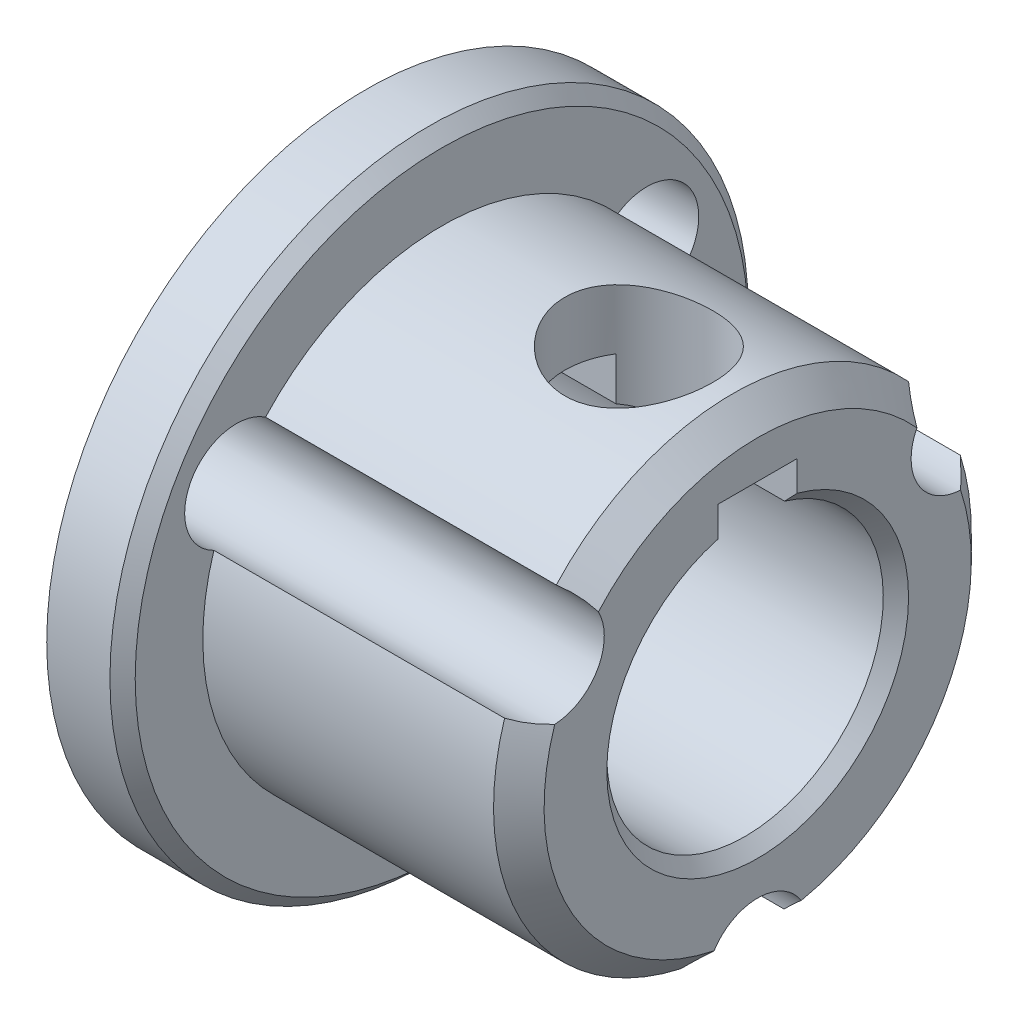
SolidWorks part; units mm, degrees
ref_plane "FRONT" through (0, 0, 0) normal (0, 0, 1) x (1, 0, 0)
ref_plane "TOP" through (0, 0, 0) normal (0, 1, 0) x (1, 0, 0)
ref_plane "SIDE" through (0, 0, 0) normal (1, 0, 0) x (0, 0, -1)
sketch "Sketch1" plane through (0, 0, 0) normal (0, 0, 1) x (1, 0, 0)
  line L0 (0, 0) -> (24.13, 0) construction
  line L1 (-3.048, 5.5562) -> (12.7, 5.5562)
  line L2 (12.7, 5.5562) -> (12.7, 9.6012)
  line L3 (12.7, 9.6012) -> (0, 9.6012)
  line L4 (0, 9.6012) -> (0, 12.827)
  line L5 (0, 12.827) -> (-3.048, 12.827)
  line L6 (-3.048, 12.827) -> (-3.048, 5.5562)
  dimension "D1" = 11.1125
  dimension "D2" = 19.2024
  dimension "D3" = 3.048
  dimension "D4" = 12.7
  dimension "D5" = 25.654
revolve "Base-Revolve" add sketch "Sketch1" angle 360 about L0
chamfer "Chamfer1" distance 0.508 angle 45
sketch "Sketch2" plane through (-3.048, 0, 0) normal (-1, 0, 0) x (0, 0, 1)
  line L0 (-1.5875, 5.3246) -> (-1.5875, 7.0612)
  line L1 (-1.5875, 7.0612) -> (1.5875, 7.0612)
  line L2 (1.5875, 7.0612) -> (1.5875, 5.3246)
  circle A0 centre (0, 0) radius 5.5562 construction
  arc A1 (1.5875, 5.3246) -> (-1.5875, 5.3246) centre (0, 0) ccw
  dimension "D1" = 1.5875
  dimension "D2" = 1.5875
  dimension "D3" = 7.0612
extrude "Key" cut sketch "Sketch2" against normal through all
chamfer "Chamfer2" distance 1.016 angle 45
sketch "Sketch3" plane through (0, 0, 0) normal (0, 1, 0) x (1, 0, 0)
  line L0 (-3.048, 0) -> (-2.54, 0) construction
  circle A0 centre (7.9248, 0) radius 2.9718
  dimension "D1" = 5.9436
  dimension "D2" = 7.9248
extrude "SetScrew" cut sketch "Sketch3" along normal through all
sketch "Sketch4" plane through (-3.048, 0, 0) normal (-1, 0, 0) x (0, 0, 1)
  line L0 (0, 14.7951) -> (0, 8.8907) construction
  circle A0 centre (0, -9.525) radius 2.0828
  circle A1 centre (-8.2489, 4.7625) radius 2.0828
  circle A2 centre (8.2489, 4.7625) radius 2.0828
  circle A3 centre (0, 0) radius 9.525 construction
  dimension "D1" = 4.1656
  dimension "D2" = 9.525
extrude "Cut-Extrude3" cut sketch "Sketch4" against normal through all
